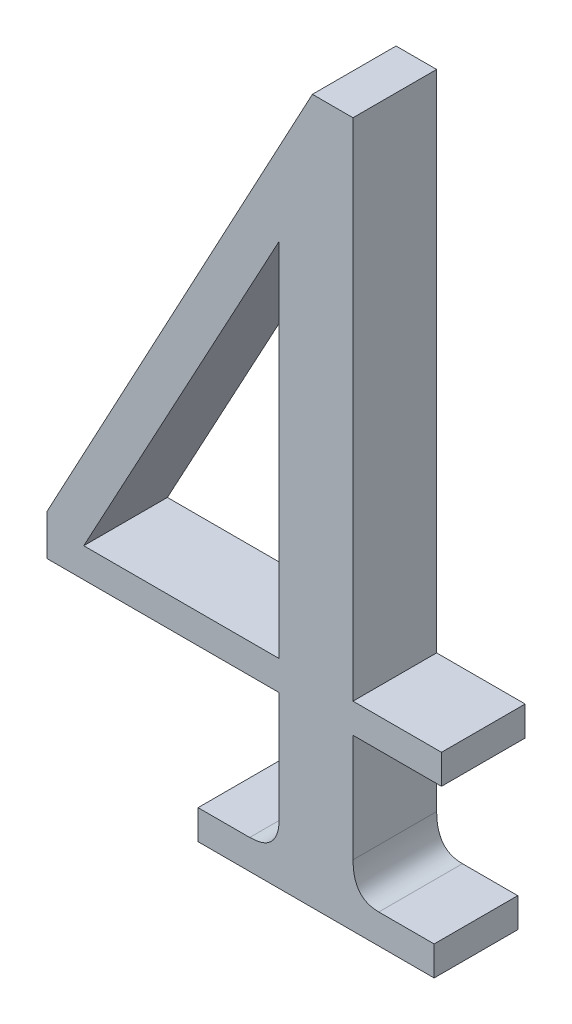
SolidWorks part; units mm, degrees
ref_plane "前基準面" through (0, 0, 0) normal (0, 0, 1) x (1, 0, 0)
ref_plane "上基準面" through (0, 0, 0) normal (0, 1, 0) x (1, 0, 0)
ref_plane "右基準面" through (0, 0, 0) normal (1, 0, 0) x (0, 0, -1)
sketch "草圖1" plane through (0, 0, 0) normal (0, 0, 1) x (1, 0, 0)
  text T0 "4" font "標楷體" height 25
extrude "填料-伸長1" add sketch "草圖1" along normal blind 3
